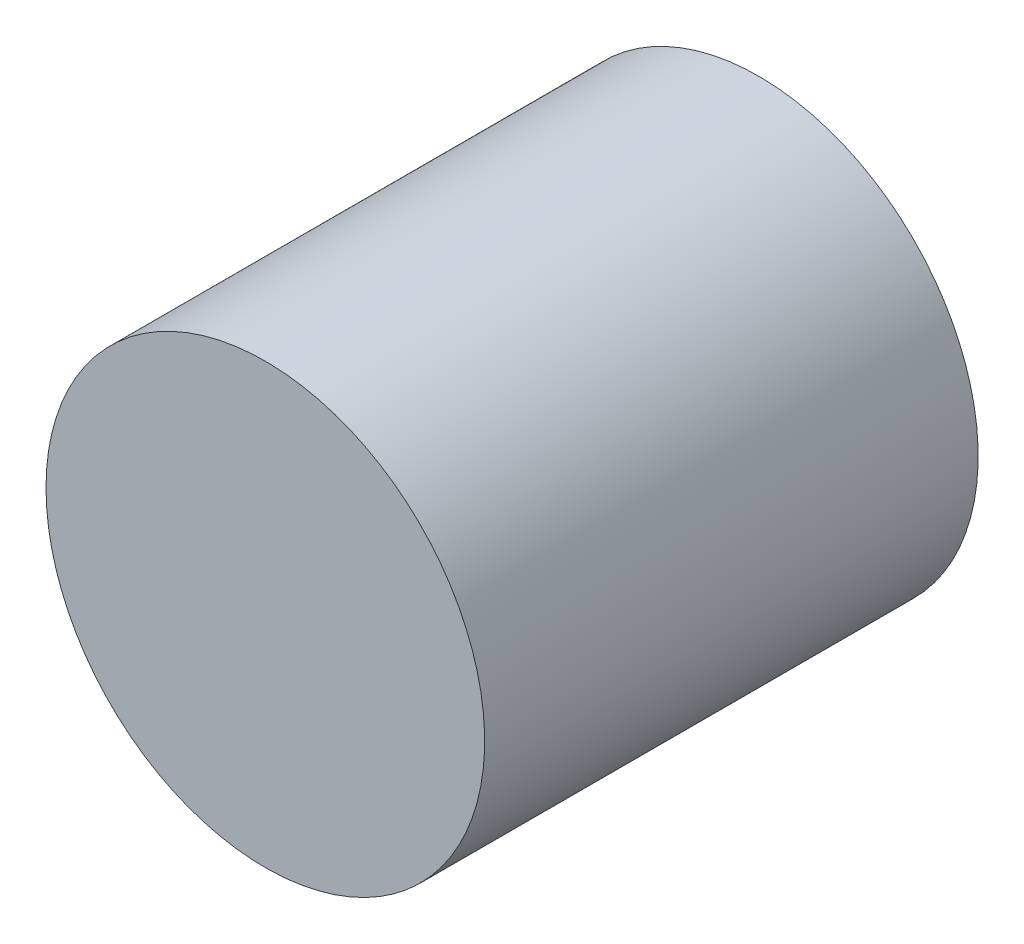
SolidWorks part; units mm, degrees
ref_plane "Front Plane" through (0, 0, 0) normal (0, 0, 1) x (1, 0, 0)
ref_plane "Top Plane" through (0, 0, 0) normal (0, 1, 0) x (1, 0, 0)
ref_plane "Right Plane" through (0, 0, 0) normal (1, 0, 0) x (0, 0, -1)
sketch "Sketch1" plane through (0, 0, 0) normal (1, 0, 0) x (0, 0, -1)
  line L0 (0, 7.3137) -> (0, 4) construction
  line L1 (0, 0) -> (-12.764, 0) construction
  line L2 (0, -2.5) -> (0, -4)
  line L3 (0, -4) -> (-9, -4)
  line L4 (-9, -4) -> (-9, 0)
  line L5 (-9, 0) -> (-6, 0)
  line L6 (-6, 0) -> (-6, -2.5)
  line L7 (-6, -2.5) -> (0, -2.5)
  line L11 (0, 2.5) -> (0, -7.3137) construction
  dimension "D1" = 5
  dimension "D2" = 8
  dimension "D3" = 9
revolve "Revolve1" add sketch "Sketch1" angle 360 about L1
